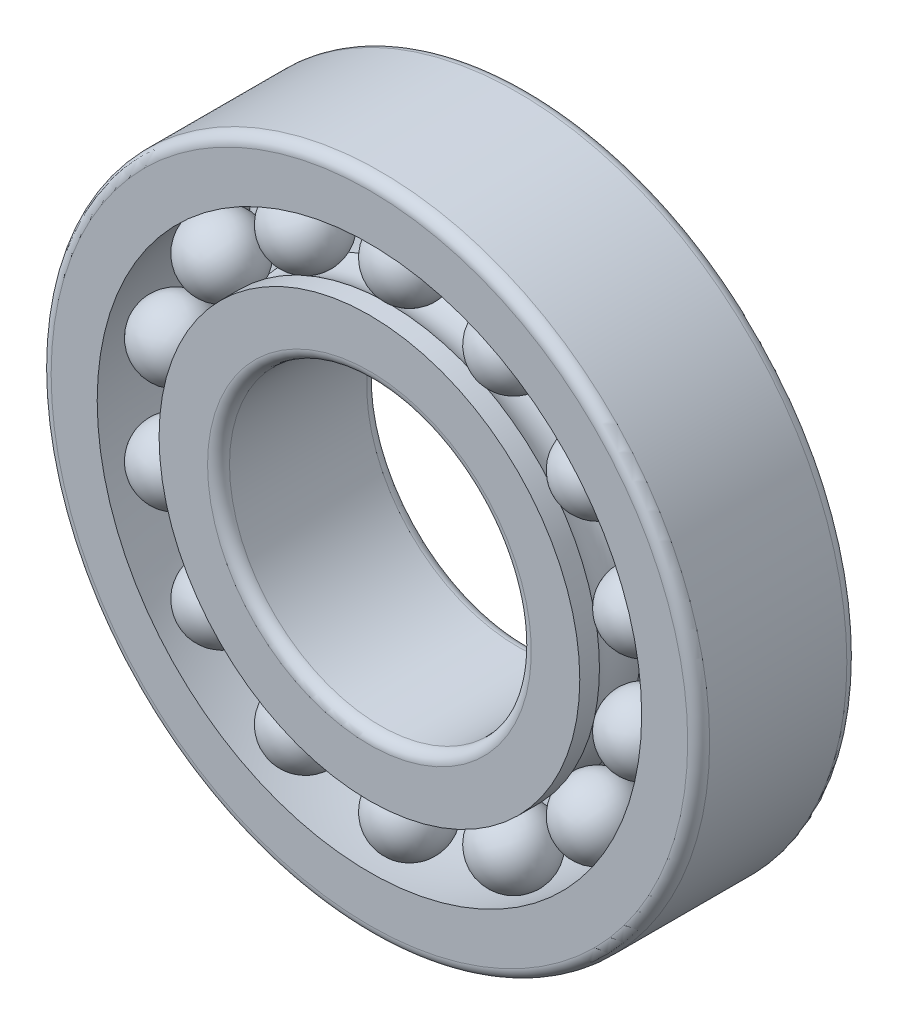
SolidWorks part; units mm, degrees
ref_plane "Front Plane" through (0, 0, 0) normal (0, 0, 1) x (1, 0, 0)
ref_plane "Top Plane" through (0, 0, 0) normal (0, 1, 0) x (1, 0, 0)
ref_plane "Right Plane" through (0, 0, 0) normal (1, 0, 0) x (0, 0, -1)
sketch "BaseSke" plane through (0, 0, 0) normal (1, 0, 0) x (0, 0, -1)
  line L0 (-47.2296, 0) -> (24.6132, 0) construction
  line L1 (-47.2296, 43.75) -> (24.6132, 43.75) construction
  line L2 (0, 129.5214) -> (0, -86.3012) construction
  line L3 (-7.1841, 50.3409) -> (-7.1841, 37.1591)
  line L4 (-14.5, 60) -> (14.5, 60) construction
  line L5 (-14.5, 27.5) -> (14.5, 27.5) construction
  line L6 (-14.5, 60) -> (-14.5, 27.5) construction
  line L7 (14.5, 60) -> (14.5, 27.5) construction
  line L8 (-13.775, 60) -> (-13.775, 27.5) construction
  arc A0 (-7.1841, 50.3409) -> (-7.1841, 37.1591) centre (-7.1841, 43.75) ccw
  dimension "D2" = 0.725
  dimension "Ball_diameter" = 13.1818
  dimension "D1" = 43.75
  dimension "Bearing_Thickness" = 29
  dimension "Bearing_Outside_Diameter" = 120
  dimension "Bearing_Inside_Diameter" = 55
revolve "Ball" add sketch "BaseSke" angle 360 about L3
sketch "OuterRaceSke" plane through (0, 0, 0) normal (1, 0, 0) x (0, 0, -1)
  line L0 (0, 0) -> (0, 87.5396) construction
  line L1 (-14.5, 60) -> (14.5, 60)
  line L2 (-14.5, 60) -> (-14.5, 49.6108)
  line L4 (14.5, 60) -> (14.5, 49.6108)
  line L5 (-50.3916, 0) -> (55.2197, 0) construction
  arc A0 (-14.5, 49.6108) -> (14.5, 49.6108) centre (0, -59.4293) cw
  arc A1 (-14.5, 49.631) -> (14.5, 49.631) centre (0, -59.4293) cw construction
  arc A2 (-7.1841, 50.3409) -> (-7.1841, 37.1591) centre (-7.1841, 43.75) ccw construction
  dimension "D1" = 110
  dimension "D2" = 0.02
revolve "OuterRace" add sketch "OuterRaceSke" angle 360 about L5
mirror "MirrorBall" about plane through (0, 0, 0) normal (0, 0, 1) of "Ball"
sketch "InnerRaceSke" plane through (0, 0, 0) normal (1, 0, 0) x (0, 0, -1)
  line L0 (-70.8626, 0) -> (113.5527, 0) construction
  line L1 (0, 58.441) -> (0, -70.8113) construction
  line L2 (-14.5, 27.5) -> (14.5, 27.5)
  line L3 (-14.5, 27.5) -> (-14.5, 38.3333)
  line L4 (-14.5, 38.3333) -> (-10.9215, 38.3333)
  line L5 (14.5, 27.5) -> (14.5, 38.3333)
  line L6 (0, 129.5214) -> (0, -86.3012) construction
  line L7 (-3.4467, 38.3333) -> (3.4467, 38.3333)
  line L8 (14.5, 38.3333) -> (10.9215, 38.3333)
  arc A0 (-10.9215, 38.3333) -> (-3.4467, 38.3333) centre (-7.1841, 43.75) ccw
  circle A1 centre (-7.1841, 43.75) radius 6.5909 construction
  arc A2 (10.9215, 38.3333) -> (3.4467, 38.3333) centre (7.1841, 43.75) cw
  point P17 (0, 27.5)
  point P23 (0, 38.3333)
  dimension "D2" = 13.1618
  dimension "D1" = 76.6667
revolve "InnerRace" add sketch "InnerRaceSke" angle 360 about L0
fillet "Fillet1" radius 2 4 edges at (27.5, 0, -14.5) (27.5, 0, 14.5) (60, 0, -14.5) (60, 0, 14.5)
pattern_circular "CirPatternBall" count 14 over 360 about axis through (0, 0, 0) along (0, 0, 1) of "Ball", "MirrorBall"
sketch "TaperSke" plane through (0, 0, 0) normal (1, 0, 0) x (0, 0, -1)
  line L0 (-14.5, 27.5) -> (14.5, 27.5)
  line L1 (14.5, 27.5) -> (14.5, 29.9167)
  line L2 (14.5, 29.9167) -> (-14.5, 27.5)
  line L7 (-41.2502, 0) -> (40.8606, 0) construction
  dimension "Taper" = 2.4167
revolve "Taper" [suppressed] cut sketch "TaperSke" angle 360 about L7
fillet "Fillet2" [suppressed] radius 2
sketch "SimplifiedSke" plane through (0, 0, 0) normal (1, 0, 0) x (0, 0, -1)
  line L0 (37.5911, 0) -> (-37.5911, 0) construction
  line L1 (0, 0) -> (0, 72.9012) construction
  circle A0 centre (-7.1841, 43.75) radius 6.5909
  circle A1 centre (-7.1841, 43.75) radius 6.5909 construction
  circle A2 centre (7.1841, 43.75) radius 6.5909
revolve "Simplified" [suppressed] add sketch "SimplifiedSke" angle 360 about L0
equation "\"D1@BaseSke\" =  (\"Bearing_Outside_Diameter@BaseSke\"  +  \"Bearing_Inside_Diameter@BaseSke\"  )  / 4"
equation "\"Ball_diameter@BaseSke\" = \"Bearing_Thickness@BaseSke\" / 2.2"
equation "\"D2@BaseSke\" = \"Bearing_Thickness@BaseSke\"/40"
equation "\"D1@InnerRaceSke\" = \"Bearing_Inside_Diameter@BaseSke\" +  ( \"Bearing_Outside_Diameter@BaseSke\" - \"Bearing_Inside_Diameter@BaseSke\" )  / 3"
equation "\"D1@CirPatternBall\" = int( \"D1@BaseSke\"* pi  * 2 / \"Ball_diameter@BaseSke\" /1.4)"
equation "\"Taper@TaperSke\" = \"Bearing_Thickness@BaseSke\"/12"
equation "\"D1@Fillet2\" = \"Fillet_radius@Fillet1\""
equation "\"D2@InnerRaceSke\" = \"Ball_diameter@BaseSke\"-0.02"
equation "\"D1@OuterRaceSke\" = \"Bearing_Inside_Diameter@BaseSke\"*2"
